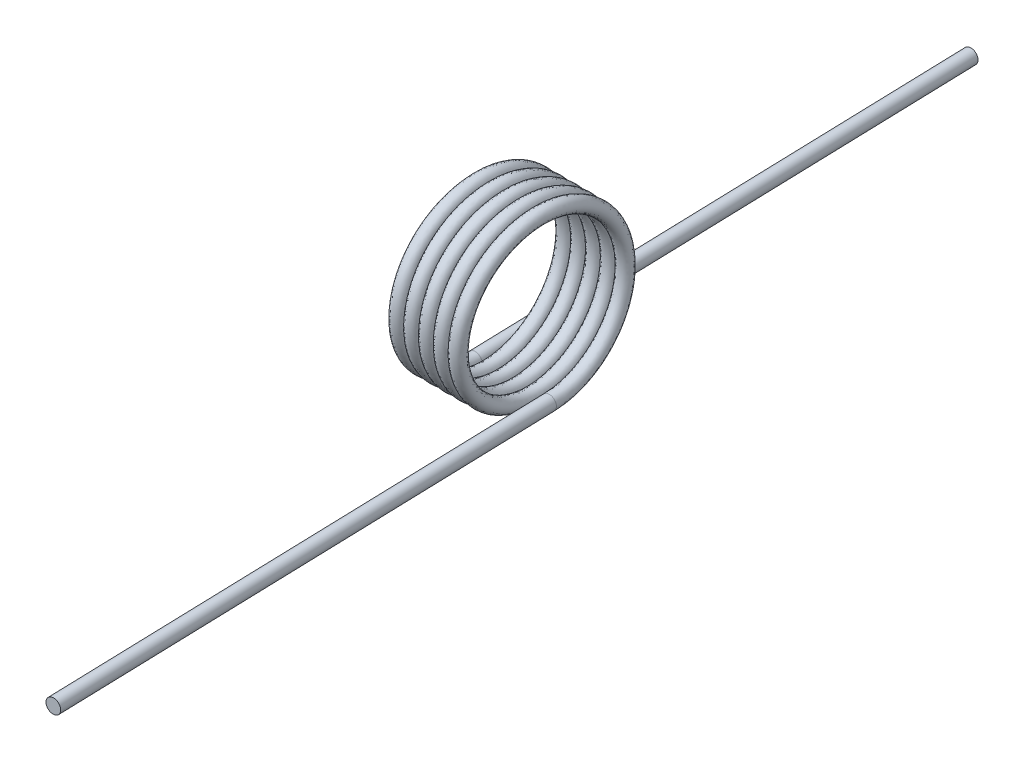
SolidWorks part; units mm, degrees
ref_plane "Front" through (0, 0, 0) normal (0, 0, 1) x (1, 0, 0)
ref_plane "Top" through (0, 0, 0) normal (0, 1, 0) x (1, 0, 0)
ref_plane "Right" through (0, 0, 0) normal (1, 0, 0) x (0, 0, -1)
sketch "Sketch1" plane through (0, 0, 0) normal (1, 0, 0) x (0, 0, -1)
  line L0 (0, 0) -> (0, -3.6068) construction
  line L1 (0, -3.6068) -> (0, -3.9624) construction
  line L2 (0, -3.9624) -> (0, -4.318) construction
  circle A0 centre (0, 0) radius 3.6068 construction
  circle A1 centre (0, 0) radius 4.318 construction
  circle A2 centre (0, 0) radius 3.9624
  circle A3 centre (0, -3.9624) radius 0.3556 construction
  circle A4 centre (0, 0) radius 2.9845 construction
  dimension "Wire Dia" = 0.7112
  dimension "Spring OD" = 8.636
  dimension "Max Rod OD" = 5.969
curve "Helix/Spiral1"
ref_plane "Plane1" through (0, -3.9624, 0) normal (0.0296, 0, 0.9996) x (0.9996, 0, -0.0296)
sketch "Sketch2" plane through (0, -3.9624, 0) normal (0.0296, 0, 0.9996) x (0.9996, 0, -0.0296)
  circle A0 centre (0, 0) radius 0.3556
  dimension "D1" = 0.7112
sweep "Sweep1" add profiles "Sketch2" path "Helix/Spiral1"
sketch "Sketch3" plane through (0, 0, 0) normal (-0.0296, 0, -0.9996) x (-0.9996, 0, 0.0296)
  circle A1 centre (0, -3.9624) radius 0.3556
  circle A2 centre (0, -3.9624) radius 0.3556
  dimension "D1" = 0
extrude "Extrude1" add sketch "Sketch3" along normal blind 25.4
sketch "Sketch4" plane through (0.0032, 0, 0.1089) normal (0.0296, 0, 0.9996) x (0.9959, -0.0856, -0.0295)
  circle A1 centre (4.0071, -3.6327) radius 0.3556
  circle A2 centre (4.0071, -3.6327) radius 0.3556
  dimension "D1" = 0
extrude "Extrude2" add sketch "Sketch4" along normal blind 25.4
sketch "Sketch5" plane through (0, 0, 0) normal (1, 0, 0) x (0, 0, -1)
  circle A0 centre (0, 0) radius 2.9845 construction
  circle A1 centre (0, 0) radius 2.9845
equation "\"D4@Helix/Spiral1\"=\"Wire Dia@Sketch1\"+.001"
equation "\"D1@Sketch2\"=\"Wire Dia@Sketch1\""
equation "\"D1@Extrude2\"=\"Leg Length@Extrude1\""
